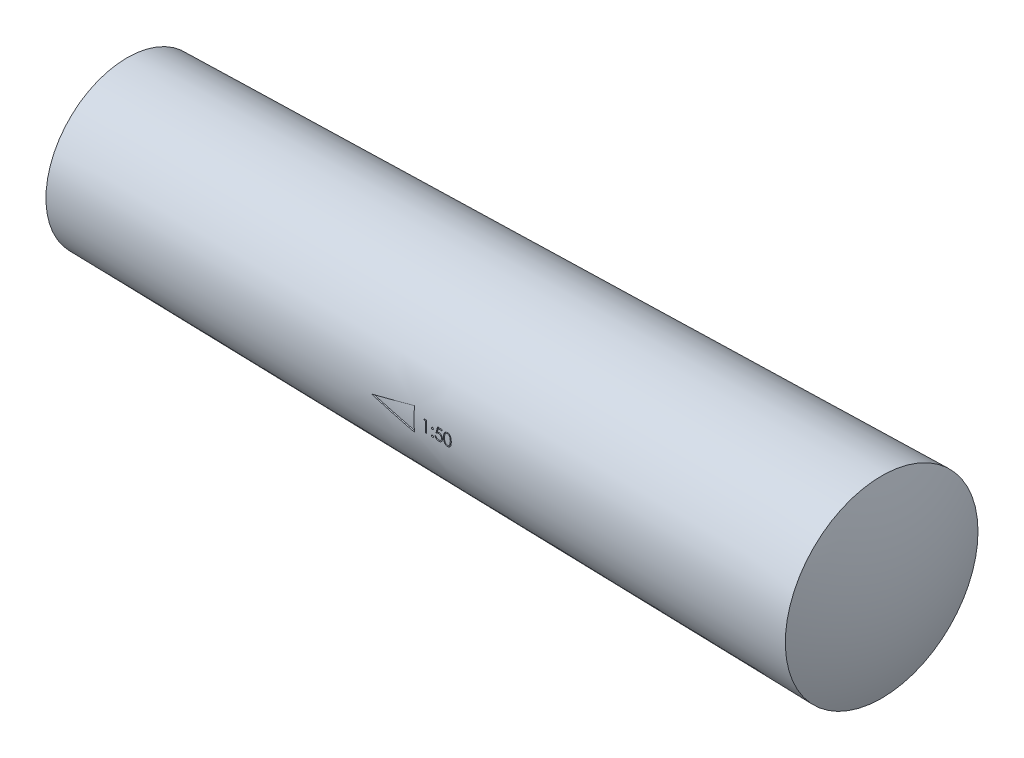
SolidWorks part; units mm, degrees
ref_plane "Front Plane" through (0, 0, 0) normal (0, 0, 1) x (1, 0, 0)
ref_plane "Top Plane" through (0, 0, 0) normal (0, 1, 0) x (1, 0, 0)
ref_plane "Right Plane" through (0, 0, 0) normal (1, 0, 0) x (0, 0, -1)
sketch "Sketch1" plane through (0, 0, 0) normal (1, 0, 0) x (0, 0, -1)
  circle A0 centre (0, 0) radius 7
  dimension "D1" = 14
extrude "Extrude1" add sketch "Sketch1" along normal mid plane 65
draft "Draft1" type of draft neutral plane draft angle 1.146 faces to draft 1 parameters "D1"=1.146
sketch "Sketch2" plane through (0, 0, 0) normal (0, 0, 1) x (1, 0, 0)
  line L0 (-32.5, 0) -> (-32.5, 7)
  line L1 (-32.5, 7) -> (-32.5, -7) construction
  line L2 (-32.5, 0) -> (-34.1, 0)
  line L3 (-34.1, 0) -> (-34.1, -7.65) construction
  line L4 (32.5, 0) -> (32.5, 8.3)
  line L5 (32.5, -8.3) -> (32.5, 8.3) construction
  line L6 (32.5, 0) -> (34.1, 0)
  line L7 (34.1, 0) -> (34.1, -7.65) construction
  line L8 (-32.5, -7) -> (32.5, -8.3) construction
  arc A0 (-34.1, 0) -> (-32.5, 7) centre (-17.9875, 0) cw
  arc A1 (34.1, 0) -> (32.5, 8.3) centre (11.7717, 0) ccw
  point P14 (0, -7.65)
revolve "Revolve1" add sketch "Sketch2" angle 360 about L2
sketch "Sketch5" plane through (0, 0, 0) normal (0, 0, 1) x (1, 0, 0)
  line L0 (0, 7.65) -> (0, -7.65) construction
  line L1 (32.5, 8.3) -> (-32.5, 7) construction
  line L2 (-32.5, -7) -> (32.5, -8.3) construction
ref_plane "Plane2" through (0, 0, 0) normal (-0.02, 0, 0.9998) x (0.9998, 0, 0.02)
sketch "Sketch6" plane through (0, 0, 0) normal (-0.02, 0, 0.9998) x (0.9998, 0, 0.02)
  line L0 (0, 0) -> (0, 1)
  line L1 (0, 7.65) -> (0, -7.65) construction
  line L2 (0, 1) -> (-3.7321, 0)
  line L3 (-3.7321, 0) -> (0, -1)
  line L4 (0, -1) -> (0, 0)
  line L5 (0, -0.5) -> (4, -0.5) construction
  text T0 "1:50" font "Century Gothic" height 1
  dimension "D1" = 2
  dimension "D2" = 30
  dimension "D3" = 4
wrap "Wrap2" sketch "Sketch6" wrap type deboss source sketch "Sketch6" thickness 0.1 parameters "D1"=0.1
equation "\"D2@Sketch2\" = \"D1@Sketch2\""
